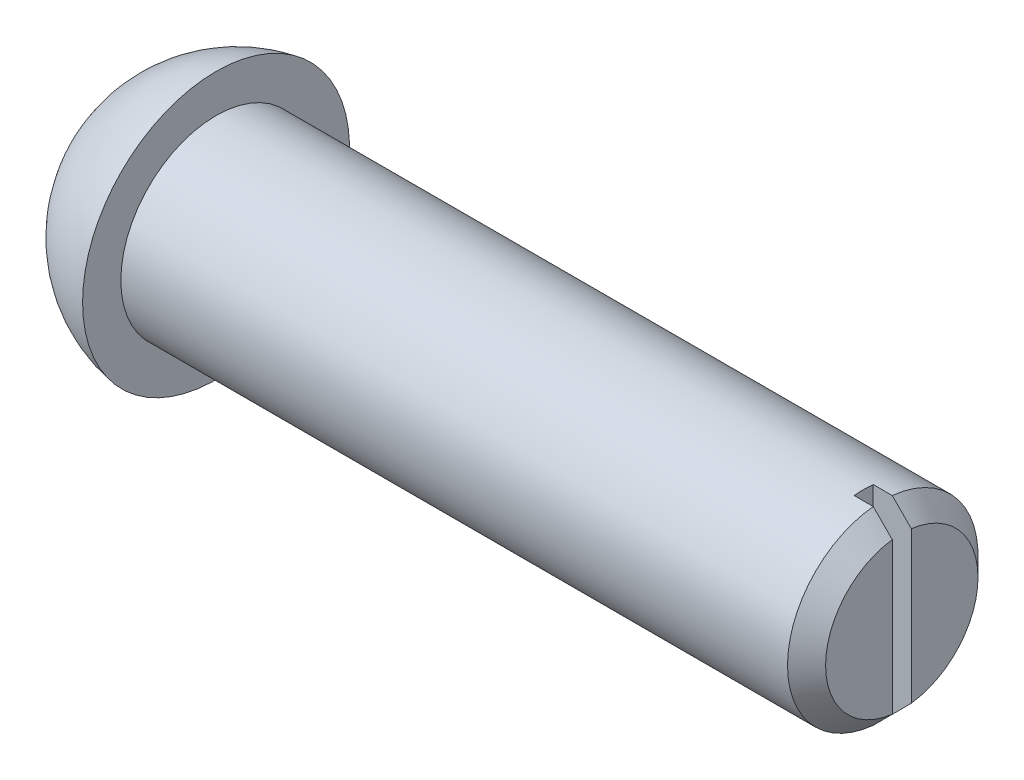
SolidWorks part; units mm, degrees
ref_plane "Plan de face" through (0, 0, 0) normal (0, 0, 1) x (1, 0, 0)
ref_plane "Plan de dessus" through (0, 0, 0) normal (0, 1, 0) x (1, 0, 0)
ref_plane "Plan de droite" through (0, 0, 0) normal (1, 0, 0) x (0, 0, -1)
sketch "Esquisse1" plane through (0, 0, 0) normal (0, 0, 1) x (1, 0, 0)
  line L0 (-45.6079, 0.0059) -> (-45.6079, -0.9977)
  line L1 (-48.6079, 2.5059) -> (-27.6079, 2.5059)
  line L3 (-45.6079, 0.0059) -> (-27.6079, 0.0059)
  line L4 (-27.6079, 2.5059) -> (-27.6079, 0.0059)
  arc A0 (-48.6079, 2.5059) -> (-45.6079, -0.9977) centre (-45.0619, 2.5059) ccw
  dimension "D2" = 3
  dimension "D4" = 3.5459
  dimension "D1" = 2.5
  dimension "D3" = 18
revolve "Révolution1" add sketch "Esquisse1" angle 360 about L1
chamfer "Chanfrein1" distance 0.5 angle 45 1 edges at (-27.6079, 2.5059, 2.5)
sketch "Esquisse2" plane through (-27.6079, 0, 0) normal (1, 0, 0) x (0, 0, -1)
  line L1 (-0.25, 5.3755) -> (0.25, 5.3755)
  line L2 (-0.25, 5.3755) -> (-0.25, -0.1952)
  line L3 (-0.25, -0.1952) -> (0.25, -0.1952)
  line L4 (0.25, 5.3755) -> (0.25, -0.1952)
  dimension "D1" = 0.5
  dimension "D2" = 0.25
extrude "Enlèv. mat.-Extru.1" cut sketch "Esquisse2" against normal blind 1
